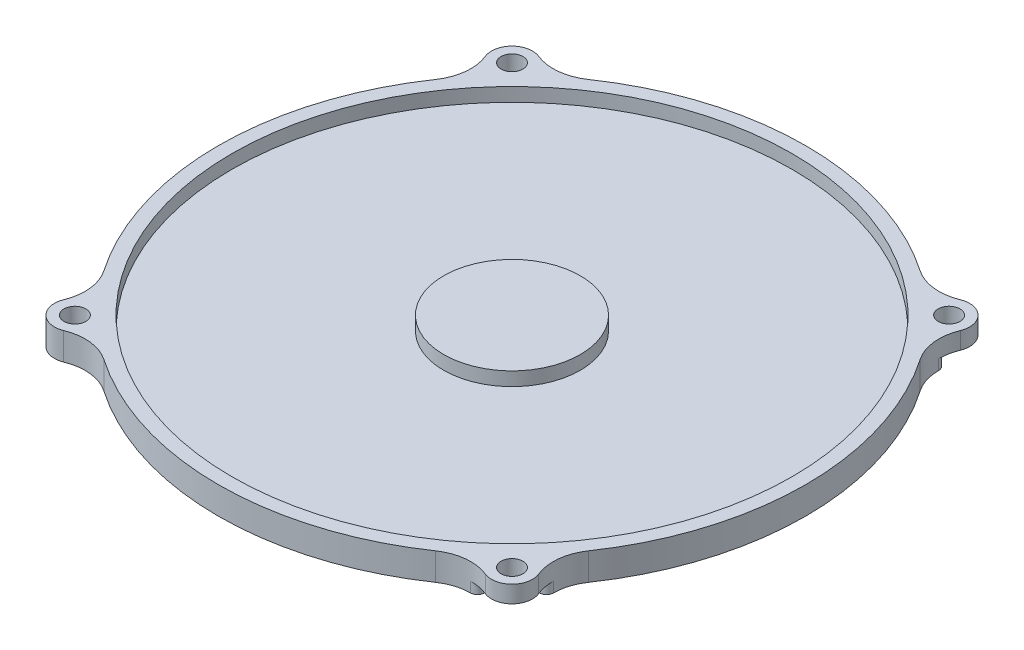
SolidWorks part; units mm, degrees
ref_plane "前视基准面" through (0, 0, 0) normal (0, 0, 1) x (1, 0, 0)
ref_plane "上视基准面" through (0, 0, 0) normal (0, 1, 0) x (1, 0, 0)
ref_plane "右视基准面" through (0, 0, 0) normal (1, 0, 0) x (0, 0, -1)
other "Configuration Table"
sketch "草图1" plane through (0, 0, 0) normal (0, 1, 0) x (1, 0, 0)
  line L0 (-32, 32) -> (32, 32) construction
  line L1 (-32, 32) -> (-32, -32) construction
  circle A0 centre (0, 0) radius 40 construction
  circle A3 centre (-32, 32) radius 1.6
  arc A4 (-34.7793, 30.8707) -> (-30.8707, 34.7793) centre (-32, 32) cw
  arc A5 (-30.8707, 34.7793) -> (-24.2826, 35.4874) centre (-28.2356, 41.2644) ccw
  arc A6 (-24.2826, 35.4874) -> (24.2826, 35.4874) centre (0, 0) cw
  arc A7 (-34.7793, 30.8707) -> (-35.4874, 24.2826) centre (-41.2644, 28.2356) cw
  arc A8 (30.8707, 34.7793) -> (34.7793, 30.8707) centre (32, 32) cw
  arc A9 (30.8707, 34.7793) -> (24.2826, 35.4874) centre (28.2356, 41.2644) cw
  arc A10 (34.7793, 30.8707) -> (35.4874, 24.2826) centre (41.2644, 28.2356) ccw
  arc A11 (35.4874, 24.2826) -> (35.4874, -24.2826) centre (0, 0) cw
  arc A12 (34.7793, -30.8707) -> (30.8707, -34.7793) centre (32, -32) cw
  arc A13 (34.7793, -30.8707) -> (35.4874, -24.2826) centre (41.2644, -28.2356) cw
  arc A14 (30.8707, -34.7793) -> (24.2826, -35.4874) centre (28.2356, -41.2644) ccw
  arc A15 (24.2826, -35.4874) -> (-24.2826, -35.4874) centre (0, 0) cw
  arc A16 (-30.8707, -34.7793) -> (-34.7793, -30.8707) centre (-32, -32) cw
  arc A17 (-30.8707, -34.7793) -> (-24.2826, -35.4874) centre (-28.2356, -41.2644) cw
  arc A18 (-34.7793, -30.8707) -> (-35.4874, -24.2826) centre (-41.2644, -28.2356) ccw
  arc A19 (-35.4874, -24.2826) -> (-35.4874, 24.2826) centre (0, 0) cw
  circle A20 centre (32, 32) radius 1.6
  circle A21 centre (32, -32) radius 1.6
  circle A22 centre (-32, -32) radius 1.6
  point P41 (0, 0)
  dimension "D2" = 80
  dimension "D3" = 4
  dimension "D4" = 3.2
  dimension "D7" = 43
  dimension "D8" = 7
  dimension "D9" = 3
  dimension "D5" = 32
  dimension "D6" = 32
  dimension "D12" = 90
  dimension "D13" = 64
  dimension "D14" = 64
  dimension "D10" = 2
  dimension "D11" = 2
extrude "凸台-拉伸1" add sketch "草图1" along normal blind 4
sketch "草图2" plane through (0, 4, 0) normal (0, 1, 0) x (1, 0, 0)
  circle A0 centre (0, 0) radius 41
  circle A1 centre (0, 0) radius 10
  dimension "D1" = 82
  dimension "D2" = 20
extrude "切除-拉伸1" cut sketch "草图2" against normal blind 2
sketch "草图3" plane through (0, 0, 0) normal (0, -1, 0) x (1, 0, 0)
  circle A0 centre (32, 32) radius 3
  circle A1 centre (32, -32) radius 3
  dimension "D1" = 6
  dimension "D2" = 6
extrude "切除-拉伸2" cut sketch "草图3" against normal blind 1.5
fillet "圆角1" radius 1 4 edges at (30.8707, 0.75, -34.7793) (34.7793, 0.75, -30.8707) (34.7793, 0.75, 30.8707) (30.8707, 0.75, 34.7793)
